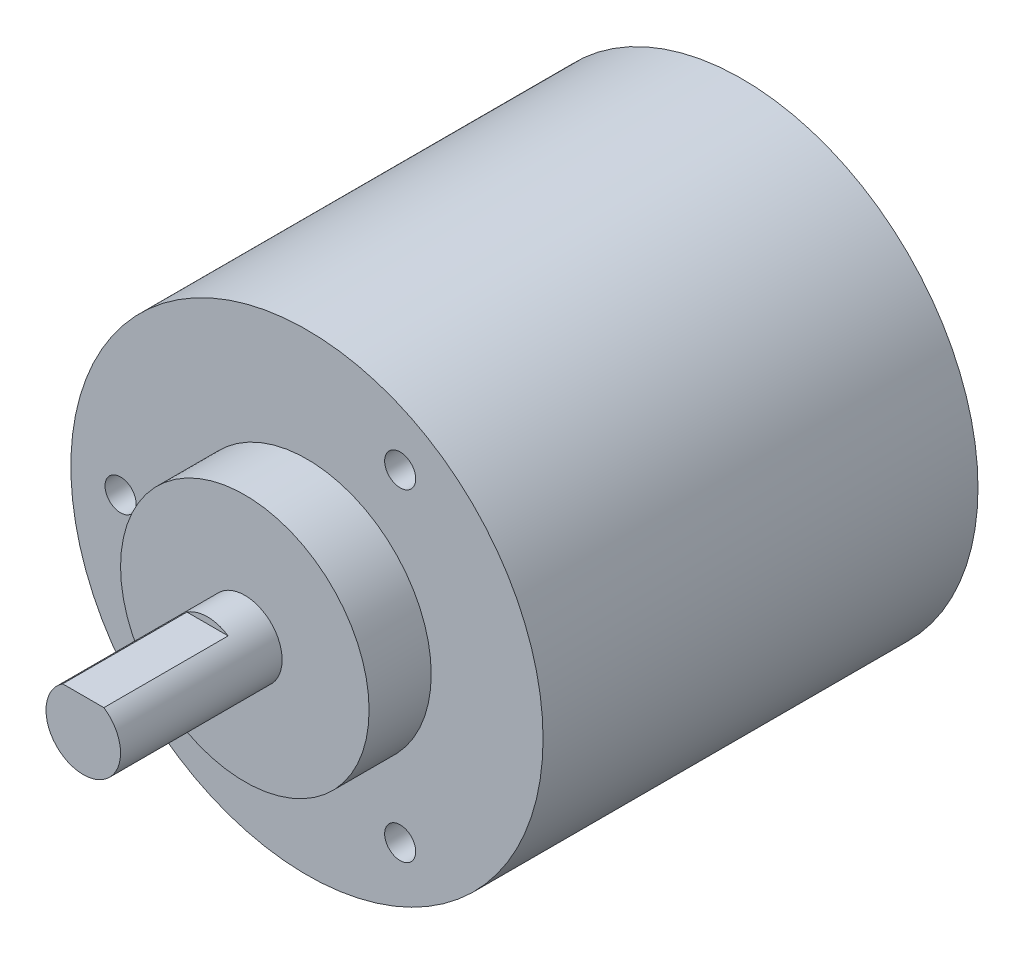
SolidWorks part; units mm, degrees
ref_plane "Piano frontale" through (0, 0, 0) normal (0, 0, 1) x (1, 0, 0)
ref_plane "Piano superiore" through (0, 0, 0) normal (0, 1, 0) x (1, 0, 0)
ref_plane "Piano destro" through (0, 0, 0) normal (1, 0, 0) x (0, 0, -1)
sketch "Schizzo1" plane through (0, 0, 0) normal (0, 0, 1) x (1, 0, 0)
  circle A0 centre (0, 0) radius 19
  dimension "D1" = 38
extrude "Estrusione-Estrusione1" add sketch "Schizzo1" along normal blind 35
sketch "Schizzo4" plane through (0, 0, 35) normal (0, 0, 1) x (1, 0, 0)
  circle A0 centre (0, 0) radius 10
  dimension "D1" = 20
extrude "Estrusione-Estrusione3" add sketch "Schizzo4" along normal blind 5
sketch "Schizzo5" plane through (0, 0, 40) normal (0, 0, 1) x (1, 0, 0)
  circle A0 centre (0, 0) radius 3
  dimension "D1" = 6
extrude "Estrusione-Estrusione4" add sketch "Schizzo5" along normal blind 13
sketch "Schizzo7" plane through (0, 0, 53) normal (0, 0, 1) x (1, 0, 0)
  line L1 (-3, 3.5) -> (3, 3.5)
  line L2 (-3, 3.5) -> (-3, 2.5)
  line L3 (-3, 2.5) -> (3, 2.5)
  line L4 (3, 3.5) -> (3, 2.5)
  line L5 (-3, 3.5) -> (3, 2.5) construction
  line L6 (-3, 2.5) -> (3, 3.5) construction
  circle A0 centre (0, 0) radius 3 construction
  circle A1 centre (0, 0) radius 3 construction
  point P0 (0, 3)
  dimension "D1" = 1
  dimension "D2" = 6
extrude "Taglio-Estrusione1" cut sketch "Schizzo7" against normal blind 10
hole_wizard "Foro filettato M3-1" positions "Schizzo8" profile "Schizzo9" tap size "M3" standard "ISO"
sketch "Schizzo8" plane through (0, 0, 35) normal (0, 0, 1) x (1, 0, 0)
  line L0 (0, 24.6642) -> (0, -25.3754) construction
  line L2 (0, 0) -> (14.1628, 24.5307) construction
  circle A0 centre (0, 0) radius 15
  point P0 (7.5, 12.9904)
  point P33 (7.5, -12.9904)
  point P34 (-15, 0)
  dimension "D1" = 30
  dimension "D2" = 30
  dimension "D3" = 3
sketch "Schizzo9" plane through (7.5, 12.9904, 35) normal (1, 0, 0) x (0, -1, 0)
  line L0 (0, 0) -> (0, 9.2511)
  line L1 (0, 9.2511) -> (1.25, 8.5)
  line L2 (1.25, 8.5) -> (1.25, 0)
  line L5 (1.25, 0) -> (0, 0)
  line L10 (0, 9.2511) -> (-1.25, 8.5) construction
  line L11 (0, -6.35) -> (0, 107.95) construction
  dimension "Tap Drill Dia." = 2.5
  dimension "Tap Drill Depth" = 8.5
  dimension "Drill Angle" = 118
